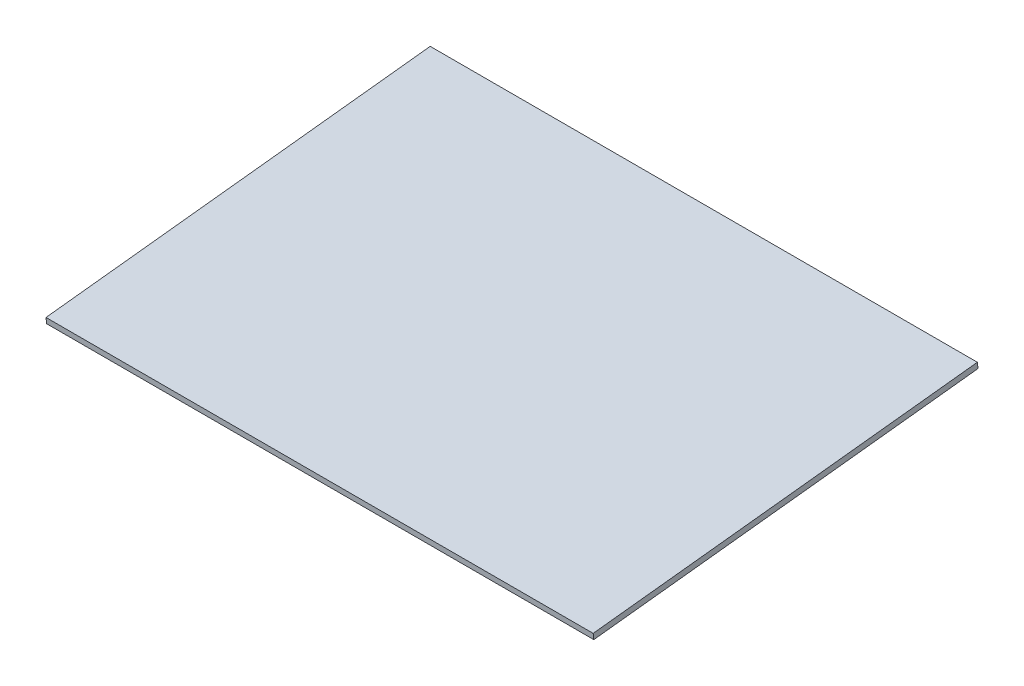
SolidWorks part; units mm, degrees
ref_plane "Front Plane" through (0, 0, 0) normal (0, 0, 1) x (1, 0, 0)
ref_plane "Top Plane" through (0, 0, 0) normal (0, 1, 0) x (1, 0, 0)
ref_plane "Right Plane" through (0, 0, 0) normal (1, 0, 0) x (0, 0, -1)
body saved out of another part "Stock-Donut Shop-1"
